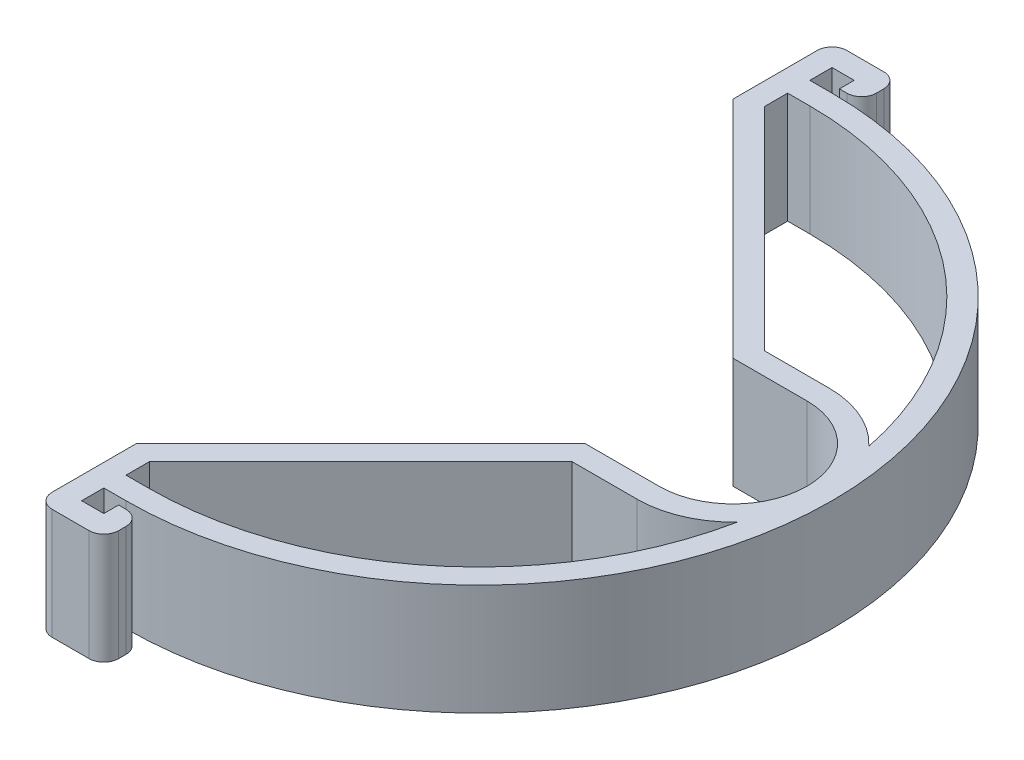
SolidWorks part; units mm, degrees
ref_plane "Front Plane" through (0, 0, 0) normal (0, 0, 1) x (1, 0, 0)
ref_plane "Top Plane" through (0, 0, 0) normal (0, 1, 0) x (1, 0, 0)
ref_plane "Right Plane" through (0, 0, 0) normal (1, 0, 0) x (0, 0, -1)
sketch "Sketch1" plane through (0, 0, 0) normal (0, 1, 0) x (1, 0, 0)
  line L1 (0, 34.3607) -> (24.3607, 10)
  line L2 (24.3607, -10) -> (0, -34.3607)
  line L8 (34.3607, 10) -> (24.3607, 10)
  line L10 (24.3607, -10) -> (34.3607, -10)
  line L12 (-6, 40.3607) -> (-6, 51.75)
  line L18 (-4, 53.75) -> (1, 53.75)
  line L19 (3, 51.75) -> (3, 50.75)
  line L20 (-3, 50.75) -> (-3, 47.75)
  line L21 (-3, 50.75) -> (0, 50.75)
  line L22 (0, 50.75) -> (0, 48.75)
  line L23 (0, 48.75) -> (1, 48.75)
  line L24 (0, 47.75) -> (-3, 47.75)
  line L25 (0, 34.3607) -> (-6, 40.3607)
  line L26 (0, 44.75) -> (-3, 44.75)
  line L27 (0, -34.3607) -> (-6, -40.3607)
  line L28 (0, -47.75) -> (-3, -47.75)
  line L29 (0, -48.75) -> (1, -48.75)
  line L30 (0, -50.75) -> (0, -48.75)
  line L31 (-3, -50.75) -> (0, -50.75)
  line L32 (-3, -50.75) -> (-3, -47.75)
  line L33 (3, -51.75) -> (3, -50.75)
  line L34 (-6, -40.3607) -> (-6, -51.75)
  line L35 (-4, -53.75) -> (1, -53.75)
  line L36 (-3, 44.75) -> (-3, 44.75)
  line L37 (-3, 44.75) -> (-3, 44.75)
  line L38 (-3, 44.75) -> (-3, 44.75)
  line L39 (-3, 44.75) -> (-3, 44.75)
  line L40 (-3, 44.75) -> (-3, 44.75)
  line L41 (-3, 44.75) -> (-3, 44.75)
  line L42 (-3, 41.6033) -> (-3, 44.75)
  line L43 (2.1213, 36.482) -> (-3, 41.6033)
  line L44 (2.1213, 36.482) -> (25.6033, 13)
  line L45 (34.3607, 13) -> (25.6033, 13)
  line L46 (25.6033, -13) -> (34.3607, -13)
  line L47 (25.6033, -13) -> (2.1213, -36.482)
  line L48 (2.1213, -36.482) -> (-3, -41.6033)
  line L49 (-3, -41.6033) -> (-3, -44.75)
  line L50 (-3, -44.75) -> (-3, -44.75)
  line L51 (-3, -44.75) -> (-3, -44.75)
  line L52 (-3, -44.75) -> (-3, -44.75)
  line L53 (-3, -44.75) -> (-3, -44.75)
  line L54 (-3, -44.75) -> (-3, -44.75)
  line L55 (-3, -44.75) -> (-3, -44.75)
  line L56 (0, -44.75) -> (-3, -44.75)
  arc A0 (0, -47.75) -> (0, 47.75) centre (0, 0) ccw
  arc A1 (34.3607, -10) -> (34.3607, 10) centre (34.3607, 0) ccw
  arc A5 (1, 48.75) -> (3, 50.75) centre (1, 50.75) ccw
  arc A7 (1, 53.75) -> (3, 51.75) centre (1, 51.75) cw
  arc A8 (-6, 51.75) -> (-4, 53.75) centre (-4, 51.75) cw
  arc A12 (-6, -51.75) -> (-4, -53.75) centre (-4, -51.75) ccw
  arc A13 (1, -53.75) -> (3, -51.75) centre (1, -51.75) ccw
  arc A14 (1, -48.75) -> (3, -50.75) centre (1, -50.75) cw
  arc A15 (0, -44.75) -> (43.8615, -8.8732) centre (0, 0) ccw
  arc A16 (-3, 44.75) -> (-3, 44.75) centre (-3, 44.75) ccw
  arc A17 (-3, 44.75) -> (-3, 44.75) centre (-3, 44.75) cw
  arc A18 (-3, 44.75) -> (-3, 44.75) centre (-3, 44.75) cw
  arc A19 (34.3607, -13) -> (43.8615, -8.8732) centre (34.3607, 0) ccw
  arc A20 (-3, -44.75) -> (-3, -44.75) centre (-3, -44.75) ccw
  arc A21 (-3, -44.75) -> (-3, -44.75) centre (-3, -44.75) ccw
  arc A22 (-3, -44.75) -> (-3, -44.75) centre (-3, -44.75) cw
  arc A23 (43.8615, 8.8732) -> (34.3607, 13) centre (34.3607, 0) ccw
  arc A24 (34.3607, -13) -> (34.3607, 13) centre (34.3607, 0) ccw construction
  arc A25 (43.8615, 8.8732) -> (0, 44.75) centre (0, 0) ccw
  arc A26 (0, -44.75) -> (0, 44.75) centre (0, 0) ccw construction
  point P21 (3, 53.75)
  point P26 (-6, 53.75)
  point P42 (-6, -53.75)
  point P43 (3, -53.75)
  dimension "D1" = 95.5
  dimension "D2" = 3
  dimension "D4" = 20
  dimension "D8" = 2
  dimension "D3" = 6
  dimension "D5" = 9
  dimension "D6" = 3
  dimension "D7" = 1
extrude "Boss-Extrude1" add sketch "Sketch1" along normal blind 15
